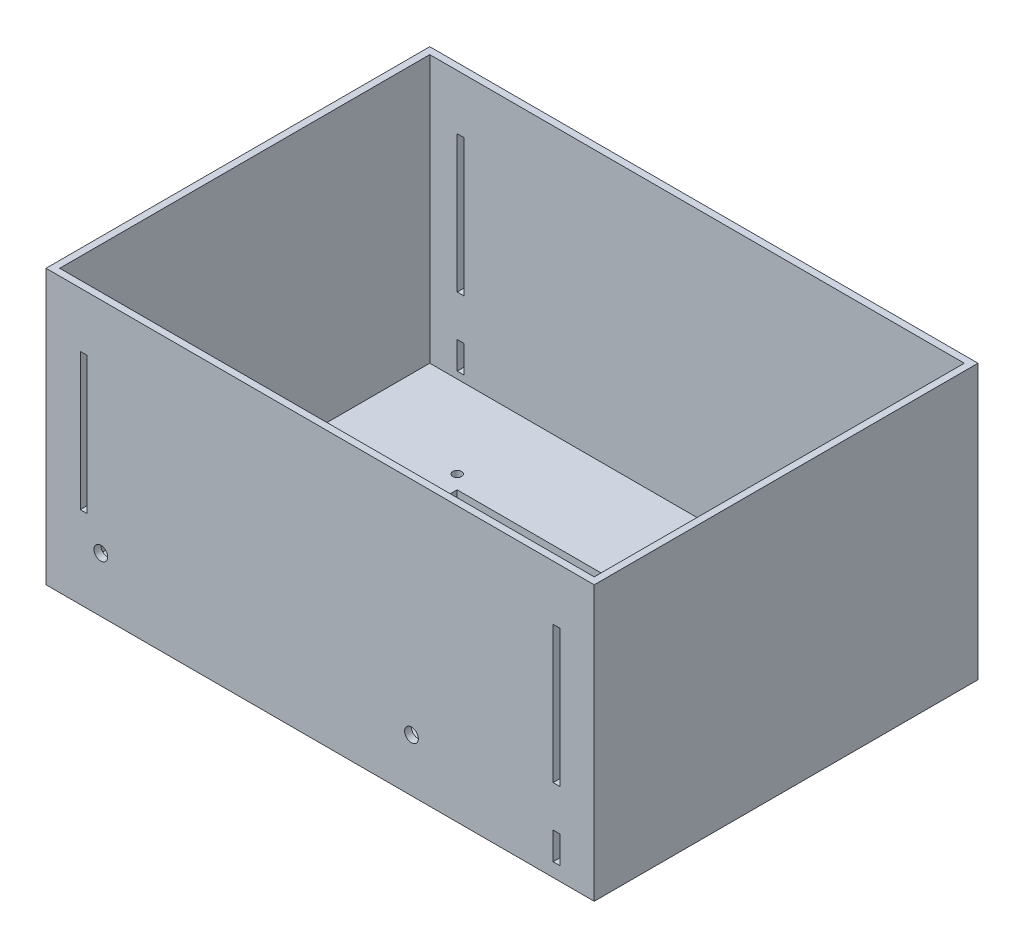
SolidWorks part; units mm, degrees
ref_plane "Front Plane" through (0, 0, 0) normal (0, 0, 1) x (1, 0, 0)
ref_plane "Top Plane" through (0, 0, 0) normal (0, 1, 0) x (1, 0, 0)
ref_plane "Right Plane" through (0, 0, 0) normal (1, 0, 0) x (0, 0, -1)
sketch "Sketch2" plane through (0, 0, 0) normal (0, 1, 0) x (1, 0, 0)
  line L4 (69.85, -44.45) -> (-69.85, -44.45)
  line L5 (69.85, -44.45) -> (69.85, 44.45)
  line L6 (69.85, 44.45) -> (-69.85, 44.45)
  line L7 (-69.85, -44.45) -> (-69.85, 44.45)
  line L8 (66.675, -41.275) -> (-66.675, -41.275)
  line L9 (-66.675, -41.275) -> (-66.675, 41.275)
  line L10 (66.675, 41.275) -> (-66.675, 41.275)
  line L11 (66.675, -41.275) -> (66.675, 41.275)
  dimension "D1" = 3.175
extrude "Boss-Extrude1" add sketch "Sketch2" against normal blind 6.35
sketch "Sketch3" plane through (0, 0, 0) normal (0, 1, 0) x (1, 0, 0)
  line L1 (-127, -88.9) -> (127, -88.9)
  line L2 (-127, -88.9) -> (-127, 88.9)
  line L3 (66.675, -38.8937) -> (69.85, -40.7458) construction
  line L4 (49.4918, 41.275) -> (66.675, 53.0402) construction
  line L5 (-87.9808, 0) -> (-66.675, 0) construction
  line L6 (-127, 88.9) -> (127, 88.9)
  line L7 (127, -88.9) -> (127, 88.9)
  line L8 (-66.675, 41.275) -> (66.675, 41.275)
  line L9 (-127, -88.9) -> (127, 88.9) construction
  line L10 (-66.675, 41.275) -> (-66.675, -41.275)
  line L11 (-66.675, -41.275) -> (66.675, -41.275)
  line L12 (66.675, 41.275) -> (66.675, -41.275)
  line L13 (49.4918, -41.275) -> (66.675, -53.0402) construction
  line L14 (-127, 88.9) -> (127, -88.9) construction
  circle A0 centre (73.025, 47.625) radius 2.0447
  circle A1 centre (-73.025, 47.625) radius 2.0447
  circle A2 centre (-73.025, -47.625) radius 2.0447
  circle A3 centre (73.025, -47.625) radius 2.0447
  point P2 (0, 0)
  point P3 (-10.7909, 0)
  point P4 (-10.7909, 0)
  point P14 (0, 0)
extrude "Boss-Extrude2" add sketch "Sketch3" along normal blind 3.175 separate body
sketch "Sketch5" plane through (0, 3.175, 0) normal (0, 1, 0) x (1, 0, 0)
  line L0 (-123.825, 85.725) -> (123.825, 85.725)
  line L1 (-127, -88.9) -> (127, -88.9)
  line L2 (-127, -88.9) -> (-127, 88.9)
  line L3 (-127, 88.9) -> (127, 88.9)
  line L4 (127, -88.9) -> (127, 88.9)
  line L5 (123.825, -85.725) -> (123.825, 85.725)
  line L6 (-123.825, -85.725) -> (123.825, -85.725)
  line L7 (-123.825, -85.725) -> (-123.825, 85.725)
  dimension "D1" = 3.175
extrude "Boss-Extrude4" add sketch "Sketch5" along normal blind 123.825
sketch "Sketch6" plane through (0, 0, 88.9) normal (0, 0, 1) x (1, 0, 0)
  line L4 (-101.6, 0) -> (-101.6, 25.4) construction
  circle A0 centre (-101.6, 25.4) radius 3.175
extrude "Cut-Extrude1" cut sketch "Sketch6" against normal blind 16.764
sketch "Sketch7" plane through (0, 0, -88.9) normal (0, 0, -1) x (-1, 0, 0)
  line L4 (-85.0062, 0) -> (-85.0062, 25.4) construction
  circle A0 centre (-85.0062, 25.4) radius 3.175
extrude "Cut-Extrude2" cut sketch "Sketch7" against normal blind 16.764
sketch "Sketch8" plane through (0, 0, 0) normal (0, 0, 1) x (1, 0, 0)
  line L1 (-111.125, 38.1) -> (-107.95, 38.1)
  line L2 (-111.125, 38.1) -> (-111.125, 50.8)
  line L4 (-107.95, 38.1) -> (-107.95, 50.8)
  line L5 (107.95, 38.1) -> (111.125, 38.1)
  line L6 (107.95, 38.1) -> (107.95, 50.8)
  line L7 (-111.125, 88.9) -> (-111.125, 101.6)
  line L8 (111.125, 38.1) -> (111.125, 50.8)
  line L9 (-111.125, 101.6) -> (-107.95, 101.6)
  line L10 (-107.95, 88.9) -> (-107.95, 101.6)
  line L12 (107.95, 88.9) -> (107.95, 101.6)
  line L13 (107.95, 101.6) -> (111.125, 101.6)
  line L14 (-139.6058, 38.1) -> (206.041, 38.1) construction
  line L15 (111.125, 88.9) -> (111.125, 101.6)
  line L17 (-111.125, 50.8) -> (-111.125, 88.9)
  line L19 (-107.95, 50.8) -> (-107.95, 88.9)
  line L21 (107.95, 50.8) -> (107.95, 88.9)
  line L23 (111.125, 50.8) -> (111.125, 88.9)
  dimension "D1" = 12.7
extrude "Cut-Extrude4" cut sketch "Sketch8" against normal through all and the other way through all
sketch "Sketch9" plane through (0, 0, 88.9) normal (0, 0, 1) x (1, 0, 0)
  line L0 (42.3291, -17.907) -> (42.3291, 24.4263) construction
  circle A0 centre (42.3291, 24.4263) radius 3.175
extrude "Cut-Extrude5" cut sketch "Sketch9" against normal through all
sketch "Sketch11" plane through (0, 0, 88.9) normal (0, 0, 1) x (1, 0, 0)
  line L5 (109.5375, 0) -> (109.5375, 6.35) construction
  line L7 (107.95, 6.35) -> (111.125, 6.35)
  line L8 (107.95, 6.35) -> (107.95, 19.05)
  line L9 (107.95, 19.05) -> (111.125, 19.05)
  line L10 (111.125, 6.35) -> (111.125, 19.05)
extrude "Cut-Extrude7" cut sketch "Sketch11" against normal blind 3.175
sketch "Sketch12" plane through (0, 0, -88.9) normal (0, 0, -1) x (-1, 0, 0)
  line L0 (109.5375, 0) -> (109.5375, 6.35) construction
  line L1 (-127, 0) -> (127, 0) construction
  line L3 (107.95, 6.35) -> (111.125, 6.35)
  line L4 (107.95, 6.35) -> (107.95, 19.05)
  line L5 (107.95, 19.05) -> (111.125, 19.05)
  line L6 (111.125, 6.35) -> (111.125, 19.05)
extrude "Cut-Extrude8" cut sketch "Sketch12" against normal blind 3.175
